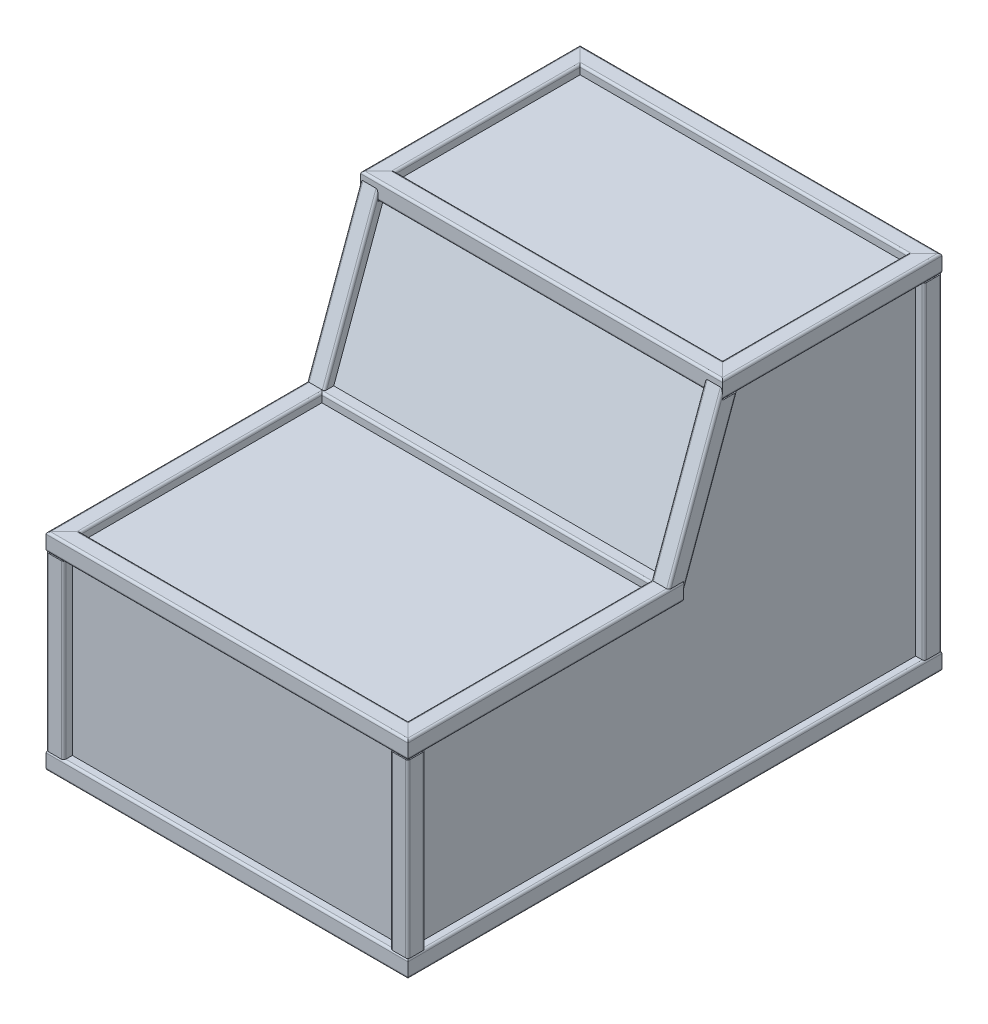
SolidWorks part; units mm, degrees
ref_plane "Front Plane" through (0, 0, 0) normal (0, 0, 1) x (1, 0, 0)
ref_plane "Top Plane" through (0, 0, 0) normal (0, 1, 0) x (1, 0, 0)
ref_plane "Right Plane" through (0, 0, 0) normal (1, 0, 0) x (0, 0, -1)
sketch "Sketch1" plane through (0, 0, 0) normal (1, 0, 0) x (0, 0, -1)
  line L0 (0, 0) -> (-3000, 0)
  line L1 (-3000, 0) -> (-3000, 1100)
  line L2 (-3000, 1100) -> (-1500, 1100)
  line L3 (-1500, 1100) -> (-1172.4268, 2000)
  line L4 (-1172.4268, 2000) -> (0, 2000)
  line L5 (0, 2000) -> (0, 0)
  dimension "D1" = 2000
  dimension "D2" = 3000
  dimension "D3" = 1100
  dimension "D4" = 1500
  dimension "D5" = 110
extrude "Boss-Extrude1" add sketch "Sketch1" against normal blind 2000
sketch3d "3DSketch2"
  line L0 (-2000, 0, 0) -> (0, 0, 0) construction
  line L1 (-2000, 2000, 1172.4268) -> (0, 2000, 1172.4268) construction
  line L2 (-2000, 2000, 0) -> (0, 2000, 0) construction
  line L3 (-2000, 1100, 3000) -> (0, 1100, 3000) construction
  line L4 (-2000, 0, 3000) -> (0, 0, 3000) construction
  line L5 (-2000, 0, 0) -> (0, 0, 0)
  line L6 (0, 0, 0) -> (0, 2000, 0)
  line L7 (0, 2000, 0) -> (0, 2000, 1172.4268)
  line L8 (0, 2000, 1172.4268) -> (0, 1100, 1500)
  line L9 (0, 1100, 1500) -> (0, 1100, 3000)
  line L10 (0, 1100, 3000) -> (0, 0, 3000)
  line L11 (0, 0, 3000) -> (0, 0, 0)
  line L12 (0, 0, 0) -> (0, 2000, 0)
  line L13 (0, 2000, 0) -> (0, 2000, 1172.4268)
  line L14 (0, 2000, 1172.4268) -> (0, 1100, 1500)
  line L15 (0, 1100, 1500) -> (0, 1100, 3000)
  line L16 (0, 1100, 3000) -> (0, 0, 3000)
  line L17 (0, 0, 3000) -> (0, 0, 0)
  line L18 (-2000, 2000, 0) -> (-2000, 0, 0)
  line L19 (-2000, 0, 0) -> (-2000, 0, 3000)
  line L20 (-2000, 0, 3000) -> (-2000, 1100, 3000)
  line L21 (-2000, 1100, 3000) -> (-2000, 1100, 1500)
  line L22 (-2000, 1100, 1500) -> (-2000, 2000, 1172.4268)
  line L23 (-2000, 2000, 1172.4268) -> (-2000, 2000, 0)
  line L24 (-2000, 2000, 0) -> (-2000, 0, 0)
  line L25 (-2000, 0, 0) -> (-2000, 0, 3000)
  line L26 (-2000, 0, 3000) -> (-2000, 1100, 3000)
  line L27 (-2000, 1100, 3000) -> (-2000, 1100, 1500)
  line L28 (-2000, 1100, 1500) -> (-2000, 2000, 1172.4268)
  line L29 (-2000, 2000, 1172.4268) -> (-2000, 2000, 0)
  line L30 (-2000, 2000, 1172.4268) -> (0, 2000, 1172.4268)
  line L31 (-2000, 2000, 0) -> (0, 2000, 0)
  line L32 (-2000, 1100, 3000) -> (0, 1100, 3000)
  line L33 (-2000, 0, 3000) -> (0, 0, 3000)
  dimension "D1" = 0
  dimension "D2" = 0
sketch3d "3DSketch1"
  line L0 (-2000, 0, 0) -> (0, 0, 0) construction
  line L1 (-2000, 0, 3000) -> (0, 0, 3000) construction
  line L2 (-2000, 1100, 3000) -> (0, 1100, 3000) construction
  line L3 (-2000, 1100, 1500) -> (0, 1100, 1500) construction
  line L4 (-2000, 2000, 1172.4268) -> (0, 2000, 1172.4268) construction
  line L5 (-2000, 2000, 0) -> (0, 2000, 0) construction
  line L6 (-2000, 0, 3000) -> (-2000, 0, 0) construction
  line L7 (-2000, 1100, 3000) -> (-2000, 0, 3000) construction
  line L8 (-2000, 1100, 1500) -> (-2000, 1100, 3000) construction
  line L9 (-2000, 2000, 1172.4268) -> (-2000, 1100, 1500) construction
  line L10 (-2000, 2000, 0) -> (-2000, 2000, 1172.4268) construction
  line L11 (-2000, 0, 0) -> (-2000, 2000, 0) construction
  line L12 (0, 0, 3000) -> (0, 0, 0) construction
  line L13 (0, 1100, 3000) -> (0, 0, 3000) construction
  line L14 (0, 1100, 1500) -> (0, 1100, 3000) construction
  line L15 (0, 2000, 1172.4268) -> (0, 1100, 1500) construction
  line L16 (0, 2000, 0) -> (0, 2000, 1172.4268) construction
  line L17 (0, 0, 0) -> (0, 2000, 0) construction
  line L18 (-2000, 0, 0) -> (0, 0, 0)
  line L19 (-2000, 0, 3000) -> (0, 0, 3000)
  line L20 (-2000, 1100, 3000) -> (0, 1100, 3000)
  line L21 (-2000, 1100, 1500) -> (0, 1100, 1500)
  line L22 (-2000, 2000, 1172.4268) -> (0, 2000, 1172.4268)
  line L23 (-2000, 2000, 0) -> (0, 2000, 0)
  line L24 (-2000, 0, 3000) -> (-2000, 0, 0)
  line L25 (-2000, 1100, 3000) -> (-2000, 0, 3000)
  line L26 (-2000, 1100, 1500) -> (-2000, 1100, 3000)
  line L27 (-2000, 2000, 1172.4268) -> (-2000, 1100, 1500)
  line L28 (-2000, 2000, 0) -> (-2000, 2000, 1172.4268)
  line L29 (-2000, 0, 0) -> (-2000, 2000, 0)
  line L30 (0, 0, 3000) -> (0, 0, 0)
  line L31 (0, 1100, 3000) -> (0, 0, 3000)
  line L32 (0, 1100, 1500) -> (0, 1100, 3000)
  line L33 (0, 2000, 1172.4268) -> (0, 1100, 1500)
  line L34 (0, 2000, 0) -> (0, 2000, 1172.4268)
  line L35 (0, 0, 0) -> (0, 2000, 0)
other "Structural Member1"
ref_plane "Plane2" through (0, 0, 3000) normal (0, 0, -1) x (1, 0, 0)
sketch "Sketch14" plane through (0, 0, 3000) normal (0, 0, -1) x (1, 0, 0)
  line L0 (-38.1, -44.45) -> (38.1, -44.45)
  line L1 (-44.45, -38.1) -> (-44.45, 38.1)
  line L2 (38.1, 44.45) -> (-38.1, 44.45)
  line L3 (44.45, 38.1) -> (44.45, -38.1)
  line L4 (-38.1, -50.8) -> (38.1, -50.8)
  line L5 (-50.8, -38.1) -> (-50.8, 38.1)
  line L6 (38.1, 50.8) -> (-38.1, 50.8)
  line L7 (50.8, 38.1) -> (50.8, -38.1)
  line L8 (0, 0) -> (44.45, 0) construction
  line L9 (0, 0) -> (0, 44.45) construction
  arc A0 (50.8, 38.1) -> (38.1, 50.8) centre (38.1, 38.1) ccw
  arc A1 (38.1, -50.8) -> (50.8, -38.1) centre (38.1, -38.1) ccw
  arc A2 (-50.8, -38.1) -> (-38.1, -50.8) centre (-38.1, -38.1) ccw
  arc A3 (-38.1, 50.8) -> (-50.8, 38.1) centre (-38.1, 38.1) ccw
  arc A4 (-38.1, 44.45) -> (-44.45, 38.1) centre (-38.1, 38.1) ccw
  arc A5 (44.45, 38.1) -> (38.1, 44.45) centre (38.1, 38.1) ccw
  arc A6 (38.1, -44.45) -> (44.45, -38.1) centre (38.1, -38.1) ccw
  arc A7 (-44.45, -38.1) -> (-38.1, -44.45) centre (-38.1, -38.1) ccw
  point P3 (0, 50.8)
  point P4 (50.8, 0)
  point P5 (0, -50.8)
  point P6 (-50.8, 0)
  point P7 (-50.8, 50.8)
  point P8 (-50.8, -50.8)
  point P33 (0, 0)
  point P35 (50.8, -50.8)
  point P36 (50.8, 50.8)
  point P37 (0, 0)
  dimension "D1" = 12.7
  dimension "Thickness" = 6.35
  dimension "V_leg" = 101.6
